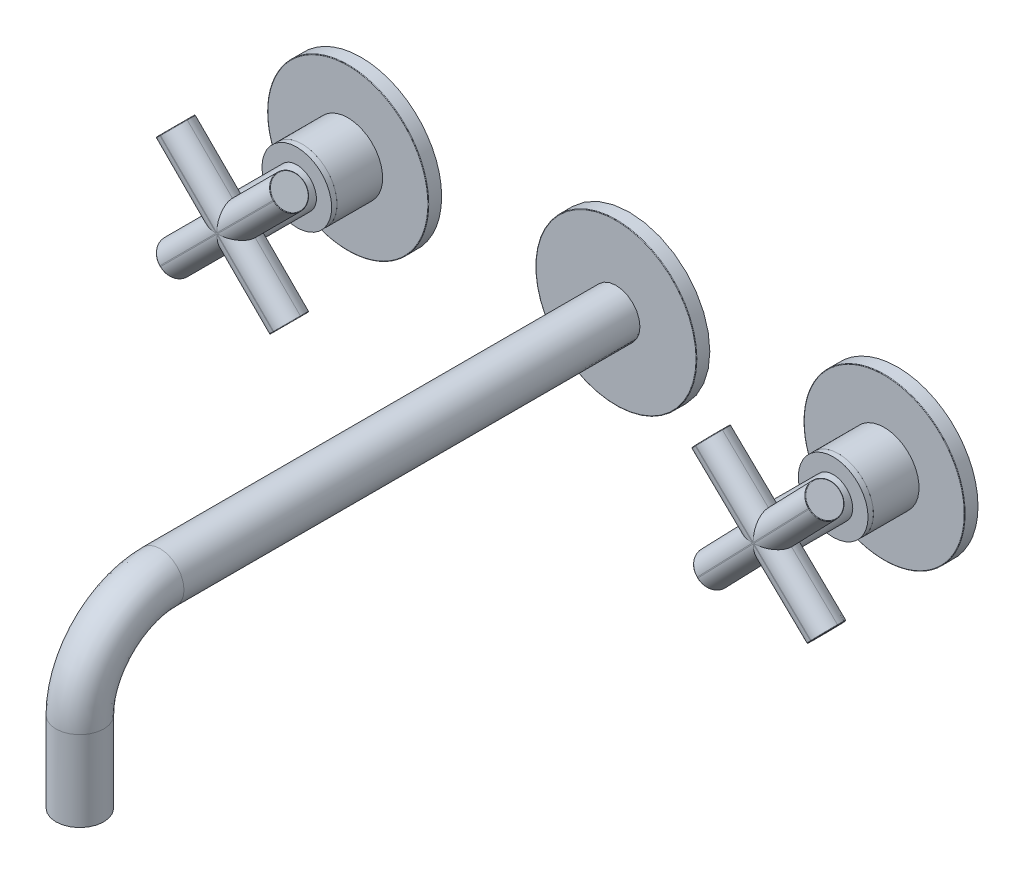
SolidWorks part; units mm, degrees
ref_plane "Front Plane" through (0, 0, 0) normal (0, 0, 1) x (1, 0, 0)
ref_plane "Top Plane" through (0, 0, 0) normal (0, 1, 0) x (1, 0, 0)
ref_plane "Right Plane" through (0, 0, 0) normal (1, 0, 0) x (0, 0, -1)
sketch "Sketch1" plane through (0, 0, 0) normal (0, 0, 1) x (1, 0, 0)
  line L0 (7.0266, -62.6003) -> (7.0266, -61.5741)
  line L1 (-7.0326, -61.5741) -> (-7.0326, -62.6003)
  line L2 (-9.2389, -0.0009) -> (-9.2389, -30.7875)
  line L3 (9.233, -30.7875) -> (9.233, 0.0018)
  line L4 (9.233, -61.5741) -> (9.233, -30.7875)
  line L5 (-9.2389, -30.7875) -> (-9.2389, -61.5741)
  line L6 (-102.625, 8.7069) -> (-120.0405, 26.1224)
  line L7 (-128.7483, 17.4147) -> (-111.3327, -0.0009)
  line L8 (-85.2094, 26.1224) -> (-102.625, 8.7069)
  line L9 (-93.9172, -0.0009) -> (-76.5017, 17.4147)
  line L10 (-111.3327, -0.0009) -> (-128.7483, -17.4164)
  line L11 (-120.0405, -26.1242) -> (-102.625, -8.7086)
  line L12 (-102.625, -8.7086) -> (-85.2094, -26.1242)
  line L13 (-76.5017, -17.4164) -> (-93.9172, -0.0009)
  line L14 (102.4671, 8.7056) -> (84.7502, 25.8145)
  line L15 (76.1958, 16.9561) -> (93.9126, -0.1528)
  line L16 (119.576, 26.4224) -> (102.4671, 8.7056)
  line L17 (111.3255, 0.1511) -> (128.4344, 17.8679)
  line L18 (102.771, -8.7073) -> (120.4878, -25.8163)
  line L19 (129.0423, -16.9578) -> (111.3255, 0.1511)
  line L20 (93.9126, -0.1528) -> (76.8037, -17.8697)
  line L21 (85.6621, -26.4241) -> (102.771, -8.7073)
  line L22 (-73.5991, -10.2631) -> (-29.0288, -10.2631)
  line L23 (29.0229, -10.2631) -> (73.5932, -10.2631)
  line L24 (73.5932, 10.2613) -> (29.0229, 10.2613)
  line L25 (-29.0288, 10.2613) -> (-73.5991, 10.2613)
  line L26 (10.958, -28.7702) -> (9.233, -29.3694)
  line L27 (7.0266, -62.6003) -> (-7.0326, -62.6003)
  line L28 (-1.0292, -63.1198) -> (1.0233, -63.1198)
  line L29 (9.233, -61.5741) -> (-9.2389, -61.5741)
  line L30 (-128.3084, -16.9766) -> (-129.7895, -14.4888)
  line L31 (-129.7895, -14.4888) -> (-131.061, -11.7994)
  line L32 (-102.625, -0.0009) -> (-111.3327, -0.0009)
  line L33 (-102.625, 8.7069) -> (-102.625, -0.0009)
  line L34 (-128.7483, 17.4147) -> (-128.6909, 17.472)
  line L35 (-128.6909, 17.472) -> (-128.439, 17.7239)
  line L36 (-128.439, 17.7239) -> (-127.998, 18.1649)
  line L37 (-127.998, 18.1649) -> (-127.3885, 18.7744)
  line L38 (-127.3885, 18.7744) -> (-126.639, 19.5239)
  line L39 (-126.639, 19.5239) -> (-125.7846, 20.3783)
  line L40 (-125.7846, 20.3783) -> (-124.8651, 21.2978)
  line L41 (-124.8651, 21.2978) -> (-123.9236, 22.2393)
  line L42 (-123.9236, 22.2393) -> (-123.0042, 23.1587)
  line L43 (-123.0042, 23.1587) -> (-122.1497, 24.0132)
  line L44 (-122.1497, 24.0132) -> (-121.4002, 24.7627)
  line L45 (-121.4002, 24.7627) -> (-120.7907, 25.3722)
  line L46 (-120.7907, 25.3722) -> (-120.3497, 25.8132)
  line L47 (-120.3497, 25.8132) -> (-120.0978, 26.0651)
  line L48 (-120.0978, 26.0651) -> (-120.0405, 26.1224)
  line L49 (-102.625, -0.0009) -> (-93.9172, -0.0009)
  line L50 (-85.2094, 26.1224) -> (-85.1521, 26.0651)
  line L51 (-85.1521, 26.0651) -> (-84.9002, 25.8132)
  line L52 (-84.9002, 25.8132) -> (-84.4592, 25.3722)
  line L53 (-84.4592, 25.3722) -> (-83.8497, 24.7627)
  line L54 (-83.8497, 24.7627) -> (-83.1002, 24.0132)
  line L55 (-83.1002, 24.0132) -> (-82.2457, 23.1587)
  line L56 (-82.2457, 23.1587) -> (-81.3263, 22.2393)
  line L57 (-81.3263, 22.2393) -> (-80.3848, 21.2978)
  line L58 (-80.3848, 21.2978) -> (-79.4653, 20.3783)
  line L59 (-79.4653, 20.3783) -> (-78.6109, 19.5239)
  line L60 (-78.6109, 19.5239) -> (-77.8614, 18.7744)
  line L61 (-77.8614, 18.7744) -> (-77.2519, 18.1649)
  line L62 (-77.2519, 18.1649) -> (-76.8109, 17.7239)
  line L63 (-76.8109, 17.7239) -> (-76.559, 17.472)
  line L64 (-76.559, 17.472) -> (-76.5017, 17.4147)
  line L65 (-102.625, -0.0009) -> (-102.625, -8.7086)
  line L66 (-120.0405, -26.1242) -> (-120.0978, -26.0668)
  line L67 (-120.0978, -26.0668) -> (-120.3497, -25.8149)
  line L68 (-120.3497, -25.8149) -> (-120.7907, -25.374)
  line L69 (-120.7907, -25.374) -> (-121.4002, -24.7645)
  line L70 (-121.4002, -24.7645) -> (-122.1497, -24.015)
  line L71 (-122.1497, -24.015) -> (-123.0042, -23.1605)
  line L72 (-123.0042, -23.1605) -> (-123.9236, -22.241)
  line L73 (-123.9236, -22.241) -> (-124.8651, -21.2996)
  line L74 (-124.8651, -21.2996) -> (-125.7846, -20.3801)
  line L75 (-125.7846, -20.3801) -> (-126.639, -19.5256)
  line L76 (-126.639, -19.5256) -> (-127.3885, -18.7761)
  line L77 (-127.3885, -18.7761) -> (-127.998, -18.1666)
  line L78 (-127.998, -18.1666) -> (-128.439, -17.7256)
  line L79 (-128.439, -17.7256) -> (-128.6909, -17.4738)
  line L80 (-128.6909, -17.4738) -> (-128.7483, -17.4164)
  line L81 (-76.5017, -17.4164) -> (-76.559, -17.4738)
  line L82 (-76.559, -17.4738) -> (-76.8109, -17.7256)
  line L83 (-76.8109, -17.7256) -> (-77.2519, -18.1666)
  line L84 (-77.2519, -18.1666) -> (-77.8614, -18.7761)
  line L85 (-77.8614, -18.7761) -> (-78.6109, -19.5256)
  line L86 (-78.6109, -19.5256) -> (-79.4653, -20.3801)
  line L87 (-79.4653, -20.3801) -> (-80.3848, -21.2996)
  line L88 (-80.3848, -21.2996) -> (-81.3263, -22.241)
  line L89 (-81.3263, -22.241) -> (-82.2457, -23.1605)
  line L90 (-82.2457, -23.1605) -> (-83.1002, -24.015)
  line L91 (-83.1002, -24.015) -> (-83.8497, -24.7645)
  line L92 (-83.8497, -24.7645) -> (-84.4592, -25.374)
  line L93 (-84.4592, -25.374) -> (-84.9002, -25.8149)
  line L94 (-84.9002, -25.8149) -> (-85.1521, -26.0668)
  line L95 (-85.1521, -26.0668) -> (-85.2094, -26.1242)
  line L96 (102.619, -0.0009) -> (101.0991, -0.0274)
  line L97 (101.0991, -0.0274) -> (99.6258, -0.0531)
  line L98 (99.6258, -0.0531) -> (98.2445, -0.0772)
  line L99 (98.2445, -0.0772) -> (96.9975, -0.099)
  line L100 (96.9975, -0.099) -> (95.9232, -0.1178)
  line L101 (95.9232, -0.1178) -> (95.0546, -0.1329)
  line L102 (95.0546, -0.1329) -> (94.4182, -0.144)
  line L103 (94.4182, -0.144) -> (94.0337, -0.1507)
  line L104 (94.0337, -0.1507) -> (93.9126, -0.1528)
  line L105 (102.4671, 8.7056) -> (102.4692, 8.5845)
  line L106 (102.4692, 8.5845) -> (102.4759, 8.2)
  line L107 (102.4759, 8.2) -> (102.487, 7.5636)
  line L108 (102.487, 7.5636) -> (102.5022, 6.6949)
  line L109 (102.5022, 6.6949) -> (102.5209, 5.6206)
  line L110 (102.5209, 5.6206) -> (102.5427, 4.3737)
  line L111 (102.5427, 4.3737) -> (102.5668, 2.9923)
  line L112 (102.5668, 2.9923) -> (102.5925, 1.5191)
  line L113 (102.5925, 1.5191) -> (102.619, -0.0009)
  line L114 (76.1958, 16.9561) -> (76.2521, 17.0144)
  line L115 (76.2521, 17.0144) -> (76.4996, 17.2707)
  line L116 (76.4996, 17.2707) -> (76.9328, 17.7193)
  line L117 (76.9328, 17.7193) -> (77.5316, 18.3393)
  line L118 (77.5316, 18.3393) -> (78.2679, 19.1018)
  line L119 (78.2679, 19.1018) -> (79.1073, 19.971)
  line L120 (79.1073, 19.971) -> (80.0106, 20.9064)
  line L121 (80.0106, 20.9064) -> (80.9355, 21.8642)
  line L122 (80.9355, 21.8642) -> (81.8388, 22.7995)
  line L123 (81.8388, 22.7995) -> (82.6782, 23.6688)
  line L124 (82.6782, 23.6688) -> (83.4145, 24.4313)
  line L125 (83.4145, 24.4313) -> (84.0132, 25.0513)
  line L126 (84.0132, 25.0513) -> (84.4465, 25.4999)
  line L127 (84.4465, 25.4999) -> (84.6939, 25.7561)
  line L128 (84.6939, 25.7561) -> (84.7502, 25.8145)
  line L129 (102.619, -0.0009) -> (104.139, 0.0257)
  line L130 (104.139, 0.0257) -> (105.6122, 0.0514)
  line L131 (105.6122, 0.0514) -> (106.9936, 0.0755)
  line L132 (106.9936, 0.0755) -> (108.2405, 0.0972)
  line L133 (108.2405, 0.0972) -> (109.3149, 0.116)
  line L134 (109.3149, 0.116) -> (110.1835, 0.1312)
  line L135 (110.1835, 0.1312) -> (110.8199, 0.1423)
  line L136 (110.8199, 0.1423) -> (111.2044, 0.149)
  line L137 (111.2044, 0.149) -> (111.3255, 0.1511)
  line L138 (119.576, 26.4224) -> (119.6344, 26.366)
  line L139 (119.6344, 26.366) -> (119.8906, 26.1186)
  line L140 (119.8906, 26.1186) -> (120.3392, 25.6854)
  line L141 (120.3392, 25.6854) -> (120.9593, 25.0866)
  line L142 (120.9593, 25.0866) -> (121.7217, 24.3503)
  line L143 (121.7217, 24.3503) -> (122.591, 23.5109)
  line L144 (122.591, 23.5109) -> (123.5263, 22.6076)
  line L145 (123.5263, 22.6076) -> (124.4841, 21.6827)
  line L146 (124.4841, 21.6827) -> (125.4195, 20.7794)
  line L147 (125.4195, 20.7794) -> (126.2887, 19.94)
  line L148 (126.2887, 19.94) -> (127.0512, 19.2037)
  line L149 (127.0512, 19.2037) -> (127.6712, 18.6049)
  line L150 (127.6712, 18.6049) -> (128.1198, 18.1717)
  line L151 (128.1198, 18.1717) -> (128.3761, 17.9243)
  line L152 (128.3761, 17.9243) -> (128.4344, 17.8679)
  line L153 (102.619, -0.0009) -> (102.6456, -1.5208)
  line L154 (102.6456, -1.5208) -> (102.6713, -2.9941)
  line L155 (102.6713, -2.9941) -> (102.6954, -4.3754)
  line L156 (102.6954, -4.3754) -> (102.7172, -5.6224)
  line L157 (102.7172, -5.6224) -> (102.7359, -6.6967)
  line L158 (102.7359, -6.6967) -> (102.7511, -7.5654)
  line L159 (102.7511, -7.5654) -> (102.7622, -8.2017)
  line L160 (102.7622, -8.2017) -> (102.7689, -8.5862)
  line L161 (102.7689, -8.5862) -> (102.771, -8.7073)
  line L162 (129.0423, -16.9578) -> (128.986, -17.0162)
  line L163 (128.986, -17.0162) -> (128.7385, -17.2724)
  line L164 (128.7385, -17.2724) -> (128.3053, -17.721)
  line L165 (128.3053, -17.721) -> (127.7065, -18.3411)
  line L166 (127.7065, -18.3411) -> (126.9702, -19.1036)
  line L167 (126.9702, -19.1036) -> (126.1308, -19.9728)
  line L168 (126.1308, -19.9728) -> (125.2275, -20.9082)
  line L169 (125.2275, -20.9082) -> (124.3026, -21.8659)
  line L170 (124.3026, -21.8659) -> (123.3993, -22.8013)
  line L171 (123.3993, -22.8013) -> (122.5599, -23.6705)
  line L172 (122.5599, -23.6705) -> (121.8236, -24.433)
  line L173 (121.8236, -24.433) -> (121.2249, -25.0531)
  line L174 (121.2249, -25.0531) -> (120.7916, -25.5017)
  line L175 (120.7916, -25.5017) -> (120.5442, -25.7579)
  line L176 (120.5442, -25.7579) -> (120.4878, -25.8163)
  line L177 (85.6621, -26.4241) -> (85.6037, -26.3678)
  line L178 (85.6037, -26.3678) -> (85.3475, -26.1204)
  line L179 (85.3475, -26.1204) -> (84.8989, -25.6871)
  line L180 (84.8989, -25.6871) -> (84.2788, -25.0884)
  line L181 (84.2788, -25.0884) -> (83.5164, -24.352)
  line L182 (83.5164, -24.352) -> (82.6471, -23.5126)
  line L183 (82.6471, -23.5126) -> (81.7118, -22.6094)
  line L184 (81.7118, -22.6094) -> (80.754, -21.6845)
  line L185 (80.754, -21.6845) -> (79.8186, -20.7812)
  line L186 (79.8186, -20.7812) -> (78.9494, -19.9418)
  line L187 (78.9494, -19.9418) -> (78.1869, -19.2055)
  line L188 (78.1869, -19.2055) -> (77.5669, -18.6067)
  line L189 (77.5669, -18.6067) -> (77.1182, -18.1735)
  line L190 (77.1182, -18.1735) -> (76.862, -17.926)
  line L191 (76.862, -17.926) -> (76.8037, -17.8697)
  line L192 (-0.003, -0.0009) -> (-0.003, -67.0618) construction
  line L193 (-93.9172, -0.0009) -> (93.9126, -0.1528) construction
  arc A0 (10.958, -28.7702) -> (-9.2389, -29.3694) centre (-0.003, -0.0009) ccw
  arc A1 (9.233, 0.0018) -> (-9.2389, -0.0009) centre (-0.003, 0.0018) ccw
  arc A2 (76.6432, 16.524) -> (77.2358, -17.4222) centre (102.619, -0.0009) ccw
  arc A3 (119.1439, 25.9749) -> (85.1977, 25.3824) centre (102.619, -0.0009) ccw
  arc A4 (128.5949, -16.5258) -> (128.0023, 17.4205) centre (102.619, -0.0009) ccw
  arc A5 (86.0942, -25.9767) -> (120.0404, -25.3842) centre (102.619, -0.0009) ccw
  arc A6 (89.8285, 3.7912) -> (89.9975, -4.3223) centre (102.619, -0.0009) ccw
  arc A7 (106.4111, 12.7897) -> (98.3829, 12.6496) centre (102.619, -0.0009) ccw
  arc A8 (115.4096, -3.7929) -> (115.2695, 4.2352) centre (102.619, -0.0009) ccw
  arc A9 (98.827, -12.7915) -> (106.8552, -12.6513) centre (102.619, -0.0009) ccw
  arc A10 (-115.3474, 4.0138) -> (-115.3474, -4.0156) centre (-102.625, -0.0009) ccw
  arc A11 (-98.6103, 12.7216) -> (-106.6396, 12.7216) centre (-102.625, -0.0009) ccw
  arc A12 (-89.9025, -4.0156) -> (-89.9025, 4.0138) centre (-102.625, -0.0009) ccw
  arc A13 (-106.6396, -12.7233) -> (-98.6103, -12.7233) centre (-102.625, -0.0009) ccw
  arc A14 (-128.3084, 16.9748) -> (-131.061, -11.7994) centre (-102.625, -0.0009) ccw
  arc A15 (-85.6493, 25.6826) -> (-119.6007, 25.6826) centre (-102.625, -0.0009) ccw
  arc A16 (-76.9415, -16.9766) -> (-76.9415, 16.9748) centre (-102.625, -0.0009) ccw
  arc A17 (-119.6007, -25.6843) -> (-85.6493, -25.6843) centre (-102.625, -0.0009) ccw
  arc A18 (-106.2284, -12.3121) -> (-99.0215, -12.3121) centre (-102.625, -0.0009) ccw
  arc A19 (-90.3103, -3.5926) -> (-90.3103, 3.5909) centre (-102.625, -0.0009) ccw
  arc A20 (-99.0215, 12.3103) -> (-106.2284, 12.3103) centre (-102.625, -0.0009) ccw
  arc A21 (-114.9362, 3.6026) -> (-114.9362, -3.6043) centre (-102.625, -0.0009) ccw
  arc A22 (99.231, -12.3731) -> (106.4368, -12.2473) centre (102.619, -0.0009) ccw
  arc A23 (114.9913, -3.3889) -> (114.8655, 3.8169) centre (102.619, -0.0009) ccw
  arc A24 (106.0071, 12.3714) -> (98.8013, 12.2456) centre (102.619, -0.0009) ccw
  arc A25 (90.2468, 3.3872) -> (90.3726, -3.8186) centre (102.619, -0.0009) ccw
  spline S0 degree 3 poles (1.0219, -63.5529) (1.299, -63.5355) (2.2375, -63.4765) (3.8483, -63.2268) (5.1287, -62.8111) (5.7779, -62.6003) knots 0 0 0 0 0.171148 0.579779 1 1 1 1
  spline S1 degree 3 poles (-5.8948, -62.6003) (-5.5796, -62.7093) (-4.6297, -63.038) (-2.9979, -63.3764) (-1.6765, -63.4771) (-1.0248, -63.5268) knots 0 0 0 0 0.201052 0.60601 1 1 1 1
  spline S2 degree 3 poles (1.0233, -63.1198) (1.0233, -63.1458) (1.0233, -63.4181) (1.0233, -63.4987) (1.0233, -63.5716) knots 0 0 0 0 0.095561 1 1 1 1
  spline S3 degree 3 poles (-1.0292, -63.1198) (-1.0292, -63.1458) (-1.0292, -63.4179) (-1.0292, -63.4984) (-1.0292, -63.5713) knots 0 0 0 0 0.095626 1 1 1 1
sketch "Sketch2" plane through (0, 0, 0) normal (1, 0, 0) x (0, 0, -1)
  line L0 (-203.3287, -62.5994) -> (-203.3287, -61.5732)
  line L1 (-217.3879, -61.5732) -> (-217.3879, -62.5994)
  line L2 (-206.3885, -63.1337) -> (-204.5775, -62.5994)
  line L3 (-179.5717, -9.236) -> (-55.3991, -9.236)
  line L4 (-43.0844, -9.236) -> (-24.6125, -9.236)
  line L5 (-24.6125, 9.236) -> (-43.0844, 9.236)
  line L6 (-55.3991, 9.236) -> (-179.5717, 9.236)
  line L7 (-201.1223, -61.5732) -> (-201.1223, -30.7866)
  line L8 (-219.5943, -30.7866) -> (-219.5943, -61.5732)
  line L9 (-0.0202, 30.7866) -> (-5.1143, 30.7866)
  line L10 (-5.1143, -30.7866) -> (-0.0013, -30.7866)
  line L11 (-55.3991, 0) -> (-55.3991, -21.3862)
  line L12 (-43.0844, -21.3862) -> (-43.0844, -5.1706)
  line L13 (-55.3991, 22.146) -> (-55.3991, 0)
  line L14 (-43.0844, 5.3544) -> (-43.0844, 22.146)
  line L15 (-43.0844, -7.4914) -> (-24.6125, -7.4914)
  line L16 (-24.6125, 7.4914) -> (-43.0844, 7.4914)
  line L17 (-55.3991, -21.3862) -> (-55.3991, -22.146)
  line L18 (-43.0844, -22.146) -> (-43.0844, -21.3862)
  line L19 (-24.6125, -12.8278) -> (-22.56, -12.8278)
  line L20 (-22.56, 12.8278) -> (-24.6125, 12.8278)
  line L21 (-5.1143, 12.8278) -> (-22.56, 12.8278)
  line L22 (-22.56, -12.8278) -> (-5.1143, -12.8278)
  line L23 (-203.3287, -62.5994) -> (-217.3879, -62.5994)
  line L24 (-210.3583, -61.5732) -> (-219.5943, -61.5732)
  line L25 (-201.1223, -61.5732) -> (-210.3583, -61.5732)
  line L26 (-5.1143, 30.7866) -> (-5.1143, -30.7866)
  line L27 (-0.0202, 30.7866) -> (-0.0013, -30.7866)
  line L28 (-43.0844, -21.3862) -> (-43.2284, -20.434)
  line L29 (-43.2284, -20.434) -> (-43.6535, -19.5264)
  line L30 (-43.6535, -19.5264) -> (-44.3399, -18.7057)
  line L31 (-44.3399, -18.7057) -> (-45.2556, -18.0104)
  line L32 (-45.2556, -18.0104) -> (-46.3576, -17.4729)
  line L33 (-46.3576, -17.4729) -> (-47.5945, -17.1184)
  line L34 (-47.5945, -17.1184) -> (-48.9084, -16.9635)
  line L35 (-48.9084, -16.9635) -> (-50.2379, -17.0153)
  line L36 (-50.2379, -17.0153) -> (-51.5208, -17.2715)
  line L37 (-51.5208, -17.2715) -> (-52.6971, -17.7202)
  line L38 (-52.6971, -17.7202) -> (-53.7119, -18.3402)
  line L39 (-53.7119, -18.3402) -> (-54.5177, -19.1027)
  line L40 (-54.5177, -19.1027) -> (-55.0767, -19.9719)
  line L41 (-55.0767, -19.9719) -> (-55.363, -20.9073)
  line L42 (-55.363, -20.9073) -> (-55.363, -21.8651)
  line L43 (-55.363, -21.8651) -> (-55.0767, -22.8004)
  line L44 (-55.0767, -22.8004) -> (-54.5177, -23.6697)
  line L45 (-54.5177, -23.6697) -> (-53.7119, -24.4321)
  line L46 (-53.7119, -24.4321) -> (-52.6971, -25.0522)
  line L47 (-52.6971, -25.0522) -> (-51.5208, -25.5008)
  line L48 (-51.5208, -25.5008) -> (-50.2379, -25.757)
  line L49 (-50.2379, -25.757) -> (-48.9084, -25.8089)
  line L50 (-48.9084, -25.8089) -> (-47.5945, -25.6539)
  line L51 (-47.5945, -25.6539) -> (-46.3576, -25.2994)
  line L52 (-46.3576, -25.2994) -> (-45.2556, -24.7619)
  line L53 (-45.2556, -24.7619) -> (-44.3399, -24.0666)
  line L54 (-44.3399, -24.0666) -> (-43.6535, -23.2459)
  line L55 (-43.6535, -23.2459) -> (-43.2284, -22.3383)
  line L56 (-43.2284, -22.3383) -> (-43.0844, -21.3862)
  line L57 (-43.0844, 22.146) -> (-43.2284, 23.0655)
  line L58 (-43.2284, 23.0655) -> (-43.6535, 23.942)
  line L59 (-43.6535, 23.942) -> (-44.3399, 24.7345)
  line L60 (-44.3399, 24.7345) -> (-45.2556, 25.406)
  line L61 (-45.2556, 25.406) -> (-46.3576, 25.925)
  line L62 (-46.3576, 25.925) -> (-47.5945, 26.2674)
  line L63 (-47.5945, 26.2674) -> (-48.9084, 26.417)
  line L64 (-48.9084, 26.417) -> (-50.2379, 26.3669)
  line L65 (-50.2379, 26.3669) -> (-51.5208, 26.1195)
  line L66 (-51.5208, 26.1195) -> (-52.6971, 25.6862)
  line L67 (-52.6971, 25.6862) -> (-53.7119, 25.0875)
  line L68 (-53.7119, 25.0875) -> (-54.5177, 24.3512)
  line L69 (-54.5177, 24.3512) -> (-55.0767, 23.5118)
  line L70 (-55.0767, 23.5118) -> (-55.363, 22.6085)
  line L71 (-55.363, 22.6085) -> (-55.363, 21.6836)
  line L72 (-55.363, 21.6836) -> (-55.0767, 20.7803)
  line L73 (-55.0767, 20.7803) -> (-54.5177, 19.9409)
  line L74 (-54.5177, 19.9409) -> (-53.7119, 19.2046)
  line L75 (-53.7119, 19.2046) -> (-52.6971, 18.6058)
  line L76 (-52.6971, 18.6058) -> (-51.5208, 18.1726)
  line L77 (-51.5208, 18.1726) -> (-50.2379, 17.9251)
  line L78 (-50.2379, 17.9251) -> (-48.9084, 17.8751)
  line L79 (-48.9084, 17.8751) -> (-47.5945, 18.0247)
  line L80 (-47.5945, 18.0247) -> (-46.3576, 18.367)
  line L81 (-46.3576, 18.367) -> (-45.2556, 18.8861)
  line L82 (-45.2556, 18.8861) -> (-44.3399, 19.5576)
  line L83 (-44.3399, 19.5576) -> (-43.6535, 20.3501)
  line L84 (-43.6535, 20.3501) -> (-43.2284, 21.2265)
  line L85 (-43.2284, 21.2265) -> (-43.0844, 22.146)
  line L86 (-43.0844, -22.146) -> (-43.2284, -23.0655)
  line L87 (-43.2284, -23.0655) -> (-43.6535, -23.942)
  line L88 (-43.6535, -23.942) -> (-44.3399, -24.7345)
  line L89 (-44.3399, -24.7345) -> (-45.2556, -25.406)
  line L90 (-45.2556, -25.406) -> (-46.3576, -25.925)
  line L91 (-46.3576, -25.925) -> (-47.5945, -26.2674)
  line L92 (-47.5945, -26.2674) -> (-48.9084, -26.417)
  line L93 (-48.9084, -26.417) -> (-50.2379, -26.3669)
  line L94 (-50.2379, -26.3669) -> (-51.5208, -26.1195)
  line L95 (-51.5208, -26.1195) -> (-52.6971, -25.6862)
  line L96 (-52.6971, -25.6862) -> (-53.7119, -25.0875)
  line L97 (-53.7119, -25.0875) -> (-54.5177, -24.3512)
  line L98 (-54.5177, -24.3512) -> (-55.0767, -23.5118)
  line L99 (-55.0767, -23.5118) -> (-55.363, -22.6085)
  line L100 (-55.363, -22.6085) -> (-55.3991, -22.146)
  line L101 (-27.716, -3.7034) -> (-25.6194, -3.7034)
  line L102 (-24.6125, -12.8278) -> (-24.6125, 12.8278)
  line L103 (-22.56, -12.8278) -> (-22.56, 12.8278)
  line L104 (-22.56, 0.5275) -> (-22.56, 12.8278)
  line L105 (-22.56, -12.8278) -> (-22.56, 0.5275)
  line L106 (-179.5717, -0.2309) -> (-55.3991, -0.2309) construction
  line L107 (-210.1274, -65.6392) -> (-210.1274, -30.7866) construction
  arc A0 (-179.5717, -9.236) -> (-201.1223, -30.7866) centre (-179.5717, -30.7866) ccw
  arc A1 (-179.5717, 9.236) -> (-219.5943, -30.7866) centre (-179.5717, -30.7866) ccw
  arc A2 (-179.5717, -0.2309) -> (-210.1274, -30.7866) centre (-179.5717, -30.7866) ccw construction
  ellipse E0 centre (-49.2417, 0) end of major axis (-43.0844, 0) minor radius 0.152 (-46.1029, 0.1307) -> (-55.3991, 0) ccw
  spline S0 degree 3 poles (-216.2501, -62.5994) (-215.9359, -62.7126) (-215.308, -62.9387) (-214.6521, -63.0612) (-214.3245, -63.1224) knots 0 0 0 0 0.500496 1 1 1 1
  spline S1 degree 3 poles (-214.3237, -63.119) (-214.1993, -63.1447) (-212.8929, -63.4148) (-210.2202, -63.756) (-207.7081, -63.3379) (-206.3928, -63.119) knots 0 0 0 0 0.047765 0.501401 1 1 1 1
  spline S2 degree 3 poles (-43.1429, -5.1715) (-43.1354, -4.9378) (-43.1156, -4.3228) (-43.5828, -3.0715) (-44.4661, -1.5483) (-45.4007, -0.4733) (-46.0195, 0.0589) (-46.1029, 0.1307) knots 0 0 0 0 0.144967 0.381516 0.639527 0.951378 1 1 1 1
  spline S3 degree 3 poles (-46.1029, 0.1307) (-45.5491, 0.6699) (-44.4994, 1.6919) (-43.5423, 3.3858) (-43.0826, 4.6535) (-43.129, 5.1925) (-43.1429, 5.3535) knots 0 0 0 0 0.338339 0.641343 0.892827 1 1 1 1
  spline S4 degree 3 poles (-28.82, -5.204) (-28.7971, -5.0289) (-28.7514, -4.6788) (-28.3965, -4.1572) (-27.8667, -3.7248) (-27.1898, -3.4544) (-26.46, -3.406) (-25.7648, -3.5771) (-25.1748, -3.9319) (-24.7574, -4.3628) (-24.6535, -4.6648) (-24.6125, -4.7842) knots 0 0 0 0 0.114018 0.22793 0.344584 0.463574 0.579443 0.691533 0.805094 0.922986 1 1 1 1
  spline S5 degree 3 poles (-24.6125, -5.601) (-24.6607, -5.7077) (-24.7773, -5.9654) (-25.2065, -6.2573) (-25.8196, -6.4706) (-26.5398, -6.5528) (-27.2585, -6.5124) (-27.9062, -6.3541) (-28.4248, -6.071) (-28.7602, -5.6793) (-28.801, -5.355) (-28.82, -5.204) knots 0 0 0 0 0.08141 0.196554 0.315497 0.433759 0.547501 0.660093 0.776509 0.895909 1 1 1 1
sketch "Sketch3" plane through (0, 0, 0) normal (0, 1, 0) x (1, 0, 0)
  line L0 (30.7866, -4.1049) -> (30.7866, 0)
  line L1 (-30.7866, 0) -> (-30.7866, -4.1049)
  line L2 (9.236, -179.5885) -> (9.236, -5.1311)
  line L3 (-9.236, -5.1311) -> (-9.236, -179.5885)
  line L4 (-9.236, -179.5885) -> (-9.236, -210.3751)
  line L5 (9.236, -210.3751) -> (9.236, -179.5885)
  line L6 (71.8354, 0) -> (71.8354, -5.1311)
  line L7 (133.4086, -5.1311) -> (133.4086, 0)
  line L8 (-133.4086, 0) -> (-133.4086, -5.1311)
  line L9 (-71.8354, -5.1311) -> (-71.8354, 0)
  line L10 (-80.8526, -43.1012) -> (-97.3587, -43.1012)
  line L11 (-102.622, -55.4159) -> (-80.8526, -55.4159)
  line L12 (-107.8853, -43.1012) -> (-124.3914, -43.1012)
  line L13 (-124.3914, -55.4159) -> (-102.622, -55.4159)
  line L14 (-95.1306, -43.1012) -> (-95.1306, -24.6293)
  line L15 (-110.1134, -24.6293) -> (-110.1134, -43.1012)
  line L16 (124.0082, -43.1012) -> (107.7926, -43.1012)
  line L17 (102.622, -55.4159) -> (124.0082, -55.4159)
  line L18 (97.2676, -43.1012) -> (80.476, -43.1012)
  line L19 (80.476, -55.4159) -> (102.622, -55.4159)
  line L20 (110.1134, -43.1012) -> (110.1134, -24.6293)
  line L21 (95.1306, -24.6293) -> (95.1306, -43.1012)
  line L22 (124.0082, -55.4159) -> (124.768, -55.4159)
  line L23 (124.768, -43.1012) -> (124.0082, -43.1012)
  line L24 (-89.7943, -24.6293) -> (-89.7943, -22.5768)
  line L25 (-115.4498, -22.5768) -> (-115.4498, -24.6293)
  line L26 (115.4498, -24.6293) -> (115.4498, -22.5768)
  line L27 (89.7942, -22.5768) -> (89.7942, -24.6293)
  line L28 (-115.4498, -5.1311) -> (-115.4498, -22.5768)
  line L29 (-89.7943, -22.5768) -> (-89.7943, -5.1311)
  line L30 (89.7942, -5.1311) -> (89.7942, -22.5768)
  line L31 (115.4498, -22.5768) -> (115.4498, -5.1311)
  line L32 (-30.7866, 0) -> (30.7866, 0)
  line L33 (29.7604, -5.1311) -> (-29.7604, -5.1311)
  line L34 (71.8354, 0) -> (133.4086, 0)
  line L35 (71.8354, -5.1311) -> (133.4086, -5.1311)
  line L36 (-133.4086, -5.1311) -> (-71.8354, -5.1311)
  line L37 (-133.4086, 0) -> (-71.8354, 0)
  line L38 (-80.8526, -43.1012) -> (-81.7885, -43.2452)
  line L39 (-81.7885, -43.2452) -> (-82.6807, -43.6703)
  line L40 (-82.6807, -43.6703) -> (-83.4874, -44.3568)
  line L41 (-83.4874, -44.3568) -> (-84.171, -45.2724)
  line L42 (-84.171, -45.2724) -> (-84.6993, -46.3744)
  line L43 (-84.6993, -46.3744) -> (-85.0478, -47.6113)
  line L44 (-85.0478, -47.6113) -> (-85.2001, -48.9252)
  line L45 (-85.2001, -48.9252) -> (-85.1491, -50.2547)
  line L46 (-85.1491, -50.2547) -> (-84.8972, -51.5376)
  line L47 (-84.8972, -51.5376) -> (-84.4563, -52.714)
  line L48 (-84.4563, -52.714) -> (-83.8468, -53.7287)
  line L49 (-83.8468, -53.7287) -> (-83.0973, -54.5345)
  line L50 (-83.0973, -54.5345) -> (-82.2428, -55.0936)
  line L51 (-82.2428, -55.0936) -> (-81.3233, -55.3798)
  line L52 (-81.3233, -55.3798) -> (-80.3819, -55.3798)
  line L53 (-80.3819, -55.3798) -> (-79.4624, -55.0936)
  line L54 (-79.4624, -55.0936) -> (-78.6079, -54.5345)
  line L55 (-78.6079, -54.5345) -> (-77.8584, -53.7287)
  line L56 (-77.8584, -53.7287) -> (-77.2489, -52.714)
  line L57 (-77.2489, -52.714) -> (-76.8079, -51.5376)
  line L58 (-76.8079, -51.5376) -> (-76.5561, -50.2547)
  line L59 (-76.5561, -50.2547) -> (-76.5051, -48.9252)
  line L60 (-76.5051, -48.9252) -> (-76.6574, -47.6113)
  line L61 (-76.6574, -47.6113) -> (-77.0059, -46.3744)
  line L62 (-77.0059, -46.3744) -> (-77.5342, -45.2724)
  line L63 (-77.5342, -45.2724) -> (-78.2177, -44.3568)
  line L64 (-78.2177, -44.3568) -> (-79.0244, -43.6703)
  line L65 (-79.0244, -43.6703) -> (-79.9166, -43.2452)
  line L66 (-79.9166, -43.2452) -> (-80.8526, -43.1012)
  line L67 (-102.622, -46.1198) -> (-102.622, -55.4159)
  line L68 (-124.3914, -43.1012) -> (-125.3274, -43.2452)
  line L69 (-125.3274, -43.2452) -> (-126.2196, -43.6703)
  line L70 (-126.2196, -43.6703) -> (-127.0263, -44.3568)
  line L71 (-127.0263, -44.3568) -> (-127.7098, -45.2724)
  line L72 (-127.7098, -45.2724) -> (-128.2381, -46.3744)
  line L73 (-128.2381, -46.3744) -> (-128.5866, -47.6113)
  line L74 (-128.5866, -47.6113) -> (-128.7389, -48.9252)
  line L75 (-128.7389, -48.9252) -> (-128.6879, -50.2547)
  line L76 (-128.6879, -50.2547) -> (-128.4361, -51.5376)
  line L77 (-128.4361, -51.5376) -> (-127.9951, -52.714)
  line L78 (-127.9951, -52.714) -> (-127.3856, -53.7287)
  line L79 (-127.3856, -53.7287) -> (-126.6361, -54.5345)
  line L80 (-126.6361, -54.5345) -> (-125.7816, -55.0936)
  line L81 (-125.7816, -55.0936) -> (-124.8622, -55.3798)
  line L82 (-124.8622, -55.3798) -> (-123.9207, -55.3798)
  line L83 (-123.9207, -55.3798) -> (-123.0012, -55.0936)
  line L84 (-123.0012, -55.0936) -> (-122.1468, -54.5345)
  line L85 (-122.1468, -54.5345) -> (-121.3973, -53.7287)
  line L86 (-121.3973, -53.7287) -> (-120.7878, -52.714)
  line L87 (-120.7878, -52.714) -> (-120.3468, -51.5376)
  line L88 (-120.3468, -51.5376) -> (-120.0949, -50.2547)
  line L89 (-120.0949, -50.2547) -> (-120.0439, -48.9252)
  line L90 (-120.0439, -48.9252) -> (-120.1962, -47.6113)
  line L91 (-120.1962, -47.6113) -> (-120.5447, -46.3744)
  line L92 (-120.5447, -46.3744) -> (-121.0731, -45.2724)
  line L93 (-121.0731, -45.2724) -> (-121.7566, -44.3568)
  line L94 (-121.7566, -44.3568) -> (-122.5633, -43.6703)
  line L95 (-122.5633, -43.6703) -> (-123.4555, -43.2452)
  line L96 (-123.4555, -43.2452) -> (-124.3914, -43.1012)
  line L97 (124.0082, -43.1012) -> (123.056, -43.2452)
  line L98 (123.056, -43.2452) -> (122.1484, -43.6703)
  line L99 (122.1484, -43.6703) -> (121.3277, -44.3568)
  line L100 (121.3277, -44.3568) -> (120.6324, -45.2724)
  line L101 (120.6324, -45.2724) -> (120.0949, -46.3744)
  line L102 (120.0949, -46.3744) -> (119.7404, -47.6113)
  line L103 (119.7404, -47.6113) -> (119.5855, -48.9252)
  line L104 (119.5855, -48.9252) -> (119.6373, -50.2547)
  line L105 (119.6373, -50.2547) -> (119.8935, -51.5376)
  line L106 (119.8935, -51.5376) -> (120.3422, -52.714)
  line L107 (120.3422, -52.714) -> (120.9622, -53.7287)
  line L108 (120.9622, -53.7287) -> (121.7247, -54.5345)
  line L109 (121.7247, -54.5345) -> (122.5939, -55.0936)
  line L110 (122.5939, -55.0936) -> (123.5293, -55.3798)
  line L111 (123.5293, -55.3798) -> (124.487, -55.3798)
  line L112 (124.487, -55.3798) -> (125.4224, -55.0936)
  line L113 (125.4224, -55.0936) -> (126.2917, -54.5345)
  line L114 (126.2917, -54.5345) -> (127.0541, -53.7287)
  line L115 (127.0541, -53.7287) -> (127.6742, -52.714)
  line L116 (127.6742, -52.714) -> (128.1228, -51.5376)
  line L117 (128.1228, -51.5376) -> (128.379, -50.2547)
  line L118 (128.379, -50.2547) -> (128.4309, -48.9252)
  line L119 (128.4309, -48.9252) -> (128.2759, -47.6113)
  line L120 (128.2759, -47.6113) -> (127.9214, -46.3744)
  line L121 (127.9214, -46.3744) -> (127.3839, -45.2724)
  line L122 (127.3839, -45.2724) -> (126.6886, -44.3568)
  line L123 (126.6886, -44.3568) -> (125.8679, -43.6703)
  line L124 (125.8679, -43.6703) -> (124.9603, -43.2452)
  line L125 (124.9603, -43.2452) -> (124.0082, -43.1012)
  line L126 (80.476, -43.1012) -> (79.5565, -43.2452)
  line L127 (79.5565, -43.2452) -> (78.68, -43.6703)
  line L128 (78.68, -43.6703) -> (77.8875, -44.3568)
  line L129 (77.8875, -44.3568) -> (77.216, -45.2724)
  line L130 (77.216, -45.2724) -> (76.697, -46.3744)
  line L131 (76.697, -46.3744) -> (76.3546, -47.6113)
  line L132 (76.3546, -47.6113) -> (76.205, -48.9252)
  line L133 (76.205, -48.9252) -> (76.2551, -50.2547)
  line L134 (76.2551, -50.2547) -> (76.5025, -51.5376)
  line L135 (76.5025, -51.5376) -> (76.9358, -52.714)
  line L136 (76.9358, -52.714) -> (77.5345, -53.7287)
  line L137 (77.5345, -53.7287) -> (78.2708, -54.5345)
  line L138 (78.2708, -54.5345) -> (79.1102, -55.0936)
  line L139 (79.1102, -55.0936) -> (80.0135, -55.3798)
  line L140 (80.0135, -55.3798) -> (80.9384, -55.3798)
  line L141 (80.9384, -55.3798) -> (81.8417, -55.0936)
  line L142 (81.8417, -55.0936) -> (82.6811, -54.5345)
  line L143 (82.6811, -54.5345) -> (83.4174, -53.7287)
  line L144 (83.4174, -53.7287) -> (84.0162, -52.714)
  line L145 (84.0162, -52.714) -> (84.4494, -51.5376)
  line L146 (84.4494, -51.5376) -> (84.6969, -50.2547)
  line L147 (84.6969, -50.2547) -> (84.7469, -48.9252)
  line L148 (84.7469, -48.9252) -> (84.5973, -47.6113)
  line L149 (84.5973, -47.6113) -> (84.255, -46.3744)
  line L150 (84.255, -46.3744) -> (83.7359, -45.2724)
  line L151 (83.7359, -45.2724) -> (83.0644, -44.3568)
  line L152 (83.0644, -44.3568) -> (82.2719, -43.6703)
  line L153 (82.2719, -43.6703) -> (81.3955, -43.2452)
  line L154 (81.3955, -43.2452) -> (80.476, -43.1012)
  line L155 (124.768, -43.1012) -> (125.6875, -43.2452)
  line L156 (125.6875, -43.2452) -> (126.564, -43.6703)
  line L157 (126.564, -43.6703) -> (127.3565, -44.3568)
  line L158 (127.3565, -44.3568) -> (128.028, -45.2724)
  line L159 (128.028, -45.2724) -> (128.547, -46.3744)
  line L160 (128.547, -46.3744) -> (128.8894, -47.6113)
  line L161 (128.8894, -47.6113) -> (129.039, -48.9252)
  line L162 (129.039, -48.9252) -> (128.9889, -50.2547)
  line L163 (128.9889, -50.2547) -> (128.7415, -51.5376)
  line L164 (128.7415, -51.5376) -> (128.3083, -52.714)
  line L165 (128.3083, -52.714) -> (127.7095, -53.7287)
  line L166 (127.7095, -53.7287) -> (126.9732, -54.5345)
  line L167 (126.9732, -54.5345) -> (126.1338, -55.0936)
  line L168 (126.1338, -55.0936) -> (125.2305, -55.3798)
  line L169 (125.2305, -55.3798) -> (124.768, -55.4159)
  line L170 (-89.7943, -24.6293) -> (-115.4498, -24.6293)
  line L171 (-89.7943, -22.5768) -> (-115.4498, -22.5768)
  line L172 (115.4498, -24.6293) -> (89.7942, -24.6293)
  line L173 (115.4498, -22.5768) -> (89.7942, -22.5768)
  line L174 (-133.4086, 0) -> (-133.4086, -5.1311)
  line L175 (89.7942, -22.5768) -> (115.4498, -22.5768)
  line L176 (115.4498, -24.6293) -> (89.7942, -24.6293)
  line L177 (89.7942, -22.5768) -> (89.7942, -5.1311)
  line L178 (94.8691, -43.1012) -> (94.8691, -24.6293)
  line L179 (-115.4498, -22.5768) -> (-89.7943, -22.5768)
  line L180 (-115.4498, -22.5768) -> (-115.4498, -5.1311)
  line L181 (133.4086, 0) -> (133.4086, -5.1311)
  arc A0 (-30.7866, -4.1049) -> (-29.7604, -5.1311) centre (-29.7604, -4.1049) ccw
  arc A1 (29.7604, -5.1311) -> (30.7866, -4.1049) centre (29.7604, -4.1049) ccw
  arc A2 (-9.236, -210.3751) -> (9.236, -210.3751) centre (0, -210.3751) ccw
  ellipse E0 centre (102.622, -49.2586) end of major axis (102.622, -43.1012) minor radius 0.152 (102.4913, -46.1198) -> (102.622, -55.4159) ccw
  spline S0 degree 3 poles (-97.3578, -43.1597) (-97.5874, -43.1522) (-98.1916, -43.1325) (-99.4309, -43.5997) (-100.9449, -44.4829) (-102.018, -45.4175) (-102.5502, -46.0363) (-102.622, -46.1198) knots 0 0 0 0 0.144967 0.381516 0.639527 0.951378 1 1 1 1
  spline S1 degree 3 poles (-102.622, -46.1198) (-103.1617, -45.566) (-104.1848, -44.5162) (-105.8896, -43.5591) (-107.1707, -43.0995) (-107.7202, -43.1458) (-107.8844, -43.1597) knots 0 0 0 0 0.338339 0.641342 0.892827 1 1 1 1
  spline S2 degree 3 poles (107.7935, -43.1597) (107.5598, -43.1522) (106.9448, -43.1325) (105.6935, -43.5997) (104.1703, -44.4829) (103.0953, -45.4175) (102.563, -46.0363) (102.4913, -46.1198) knots 0 0 0 0 0.144967 0.381516 0.639527 0.951378 1 1 1 1
  spline S3 degree 3 poles (102.4913, -46.1198) (101.9521, -45.566) (100.9301, -44.5162) (99.2363, -43.5591) (97.9685, -43.0995) (97.4295, -43.1458) (97.2685, -43.1597) knots 0 0 0 0 0.338338 0.641341 0.892828 1 1 1 1
sketch "Sketch4" plane through (0, 0, 0) normal (0, 0, 1) x (1, 0, 0)
  circle A0 centre (-102.625, -0.0009) radius 30.7866
  arc A1 (-85.6493, 25.6826) -> (-119.6007, 25.6826) centre (-102.625, -0.0009) ccw construction
  circle A2 centre (-0.003, -0.0009) radius 30.7866
  circle A3 centre (102.619, -0.0009) radius 30.7866
  arc A4 (10.958, -28.7702) -> (-9.2389, -29.3694) centre (-0.003, -0.0009) ccw construction
  arc A5 (119.1439, 25.9749) -> (85.1977, 25.3824) centre (102.619, -0.0009) ccw construction
extrude "Extrude1" add sketch "Sketch4" along normal up to vertex
sketch "Sketch5" plane through (0, 0, 5.1143) normal (0, 0, 1) x (1, 0, 0)
  circle A0 centre (-102.625, -0.0009) radius 13.3409
  circle A2 centre (102.619, -0.0009) radius 13.3409
  arc A3 (115.4096, -3.7929) -> (115.2695, 4.2352) centre (102.619, -0.0009) ccw construction
  arc A4 (-98.6103, 12.7216) -> (-106.6396, 12.7216) centre (-102.625, -0.0009) ccw construction
extrude "Extrude2" add sketch "Sketch5" along normal up to vertex
sketch "Sketch6" plane through (0, 0, 22.5768) normal (0, 0, 1) x (1, 0, 0)
  circle A1 centre (-102.625, -0.0009) radius 13.3409
  circle A2 centre (-102.625, -0.0009) radius 13.3409
  circle A3 centre (102.619, -0.0009) radius 13.3409
  circle A4 centre (102.619, -0.0009) radius 13.3409
  dimension "D1" = 0
  dimension "D2" = 0
extrude "Extrude3" add sketch "Sketch6" along normal up to vertex separate body
sketch "Sketch10" plane through (0, 0, 24.6293) normal (0, 0, 1) x (1, 0, 0)
  circle A0 centre (-102.625, -0.0009) radius 7.4944
  circle A1 centre (102.619, -0.0009) radius 7.4944
extrude "Extrude4" add sketch "Sketch10" along normal up to vertex
sketch "Sketch11" plane through (0, 0, 49.2586) normal (0, 0, 1) x (1, 0, 0)
  line L0 (-85.2094, 26.1224) -> (-102.625, 8.7069) construction
  line L1 (-93.9172, -0.0009) -> (-76.5017, 17.4147) construction
  line L2 (-76.5017, -17.4164) -> (-93.9172, -0.0009) construction
  line L3 (-102.625, -8.7086) -> (-85.2094, -26.1242) construction
  line L4 (-120.0405, -26.1242) -> (-102.625, -8.7086) construction
  line L5 (-111.3327, -0.0009) -> (-128.7483, -17.4164) construction
  line L6 (-128.7483, 17.4147) -> (-111.3327, -0.0009) construction
  line L7 (-102.625, 8.7069) -> (-120.0405, 26.1224) construction
  line L8 (-85.2094, 26.1224) -> (-102.625, 8.7069)
  line L9 (-93.9172, -0.0009) -> (-76.5017, 17.4147)
  line L10 (-76.5017, -17.4164) -> (-93.9172, -0.0009)
  line L11 (-102.625, -8.7086) -> (-85.2094, -26.1242)
  line L12 (-120.0405, -26.1242) -> (-102.625, -8.7086)
  line L13 (-111.3327, -0.0009) -> (-128.7483, -17.4164)
  line L14 (-128.7483, 17.4147) -> (-111.3327, -0.0009)
  line L15 (-102.625, 8.7069) -> (-120.0405, 26.1224)
  line L16 (119.576, 26.4224) -> (102.4671, 8.7056) construction
  line L17 (111.3255, 0.1511) -> (128.4344, 17.8679) construction
  line L18 (129.0423, -16.9578) -> (111.3255, 0.1511) construction
  line L19 (102.771, -8.7073) -> (120.4878, -25.8163) construction
  line L20 (85.6621, -26.4241) -> (102.771, -8.7073) construction
  line L21 (93.9126, -0.1528) -> (76.8037, -17.8697) construction
  line L22 (76.1958, 16.9561) -> (93.9126, -0.1528) construction
  line L23 (102.4671, 8.7056) -> (84.7502, 25.8145) construction
  line L24 (119.576, 26.4224) -> (102.4671, 8.7056)
  line L25 (111.3255, 0.1511) -> (128.4344, 17.8679)
  line L26 (129.0423, -16.9578) -> (111.3255, 0.1511)
  line L27 (102.771, -8.7073) -> (120.4878, -25.8163)
  line L28 (85.6621, -26.4241) -> (102.771, -8.7073)
  line L29 (93.9126, -0.1528) -> (76.8037, -17.8697)
  line L30 (76.1958, 16.9561) -> (93.9126, -0.1528)
  line L31 (102.4671, 8.7056) -> (84.7502, 25.8145)
  line L32 (119.576, 26.4224) -> (128.4344, 17.8679)
  line L33 (84.7502, 25.8145) -> (76.1958, 16.9561)
  line L34 (76.8037, -17.8697) -> (85.6621, -26.4241)
  line L35 (120.4878, -25.8163) -> (129.0423, -16.9578)
  line L36 (-85.2094, 26.1224) -> (-76.5017, 17.4147)
  line L37 (-120.0405, 26.1224) -> (-128.7483, 17.4147)
  line L38 (-128.7483, -17.4164) -> (-120.0405, -26.1242)
  line L39 (-85.2094, -26.1242) -> (-76.5017, -17.4164)
extrude "Extrude5" add sketch "Sketch11" along normal mid plane 12
fillet "Fillet1" radius 6 16 edges at (-85.2094, 8.7069, 55.2586) (-111.3327, -17.4164, 43.2586) (-120.0405, -8.7086, 43.2586) (-120.0405, -8.7086, 55.2586) (-111.3327, -17.4164, 55.2586) (-93.9172, -17.4164, 55.2586) (-85.2094, -8.7086, 55.2586) (-111.3327, 17.4147, 55.2586) (-93.9172, 17.4147, 55.2586) (-93.9172, -17.4164, 43.2586) (-85.2094, -8.7086, 43.2586) (-85.2094, 8.7069, 43.2586) (-93.9172, 17.4147, 43.2586) (-120.0405, 8.7069, 43.2586) (-111.3327, 17.4147, 43.2586) (-120.0405, 8.7069, 55.2586)
fillet "Fillet2" radius 6 15 edges at (111.6294, -17.2618, 43.2586) (85.0542, 8.4016, 43.2586) (93.6087, 17.26, 43.2586) (111.0215, 17.564, 43.2586) (85.3581, -9.0113, 55.2586) (94.2165, -17.5657, 55.2586) (94.2165, -17.5657, 43.2586) (120.1839, -8.4034, 43.2586) (120.1839, -8.4034, 55.2586) (111.6294, -17.2618, 55.2586) (85.0542, 8.4016, 55.2586) (93.6087, 17.26, 55.2586) (111.0215, 17.564, 55.2586) (119.88, 9.0095, 43.2586) (119.88, 9.0095, 55.2586)
fillet "Fillet3" radius 0.2 24 edges at (-77.7443, -18.659, 45.0159) (-80.8555, -21.7703, 43.2586) (-83.9668, -24.8815, 45.0159) (-83.9668, -24.8815, 53.5012) (-80.8555, -21.7703, 55.2586) (-121.2831, -24.8815, 45.0159) (-124.3944, -21.7703, 43.2586) (-127.5056, -18.659, 45.0159) (-127.5056, -18.659, 53.5012) (-124.3944, -21.7703, 55.2586) (-124.3944, 21.7685, 55.2586) (-127.5056, 18.6573, 53.5012) (-127.5056, 18.6573, 45.0159) (-124.3944, 21.7685, 43.2586) (-121.2831, 24.8798, 45.0159) (-80.8555, 21.7685, 55.2586) (-83.9668, 24.8798, 53.5012) (-83.9668, 24.8798, 45.0159) (-80.8555, 21.7685, 43.2586) (-77.7443, 18.6573, 45.0159) (-77.7443, -18.659, 53.5012) (-121.2831, -24.8815, 53.5012) (-121.2831, 24.8798, 53.5012) (-77.7443, 18.6573, 53.5012)
fillet "Fillet4" radius 0.2 24 edges at (127.8215, -18.222, 45.0159) (124.7651, -21.387, 43.2586) (121.7086, -24.5521, 45.0159) (121.7086, -24.5521, 53.5012) (124.7651, -21.387, 55.2586) (79.0749, -20.0629, 43.2586) (84.3979, -25.2034, 45.0159) (76.8037, -17.8697, 46.2586) (78.0678, -19.0904, 53.5012) (81.2329, -22.1469, 55.2586) (120.8402, 25.2016, 45.0159) (124.0052, 22.1451, 43.2586) (127.1703, 19.0887, 45.0159) (127.1703, 19.0887, 53.5012) (124.0052, 22.1451, 55.2586) (80.473, 21.3853, 55.2586) (77.4166, 18.2202, 53.5012) (77.4166, 18.2202, 45.0159) (80.473, 21.3853, 43.2586) (83.5295, 24.5504, 45.0159) (127.8215, -18.222, 53.5012) (84.3979, -25.2034, 53.5012) (120.8402, 25.2016, 53.5012) (83.5295, 24.5504, 53.5012)
sketch "Sketch12" plane through (0, 0, 5.1143) normal (0, 0, 1) x (1, 0, 0)
  line L0 (-93.9172, -0.0009) -> (93.9126, -0.1528) construction
  circle A0 centre (-0.0023, -0.0769) radius 9.1573
  arc A1 (9.233, 0.0018) -> (-9.2389, -0.0009) centre (-0.003, 0.0018) ccw construction
sketch "Sketch13" plane through (0, 0, 0) normal (1, 0, 0) x (0, 0, -1)
  line L0 (-179.5717, -0.2309) -> (-55.3991, -0.2309) construction
  line L1 (-210.1274, -65.6392) -> (-210.1274, -30.7866) construction
  line L2 (-179.5717, -0.2309) -> (-5.1143, -0.2309)
  line L3 (-210.1274, -61.5732) -> (-210.1274, -30.7866)
  line L4 (-5.1143, 9.0804) -> (-5.1143, -9.2341) construction
  line L6 (-201.1223, -61.5732) -> (-210.3583, -61.5732) construction
  arc A0 (-179.5717, -0.2309) -> (-210.1274, -30.7866) centre (-179.5717, -30.7866) ccw construction
  arc A1 (-179.5717, -0.2309) -> (-210.1274, -30.7866) centre (-179.5717, -30.7866) ccw
sweep "Sweep1" add profiles "Sketch12" path "Sketch13"
sketch "Sketch14" plane through (0, 0, 0) normal (1, 0, 0) x (0, 0, -1)
  line L0 (-210.1274, -65.6392) -> (-210.1274, -30.7866) construction
  line L1 (-201.1223, -61.5732) -> (-210.3583, -61.5732) construction
  line L2 (-203.3287, -62.5994) -> (-203.3287, -61.5732) construction
  line L3 (-203.3287, -62.5994) -> (-217.3879, -62.5994) construction
  line L4 (-206.3885, -63.1337) -> (-204.5775, -62.5994) construction
  line L5 (-210.1274, -63.5676) -> (-210.1274, -61.5732)
  line L6 (-203.3287, -61.5732) -> (-210.1274, -61.5732)
  line L7 (-203.3287, -62.5994) -> (-203.3287, -61.5732)
  line L8 (-203.3287, -62.5994) -> (-204.5775, -62.5994)
  line L9 (-206.3885, -63.1337) -> (-204.5775, -62.5994)
  line L10 (-210.1274, -63.5676) -> (-210.1274, -22.4636) construction
  line L11 (-206.3885, -63.1337) -> (-206.3928, -63.119)
  spline S0 degree 3 poles (-573.1168, -996.534) (-236.3207, -48.6511) (-225.8597, -61.7593) (-187.5351, -66.6522) (-165.5543, 3.1476) (-94.5057, -1056.8293) knots -4.85149 -4.85149 -4.85149 -4.85149 0.047765 0.501401 9.487552 9.487552 9.487552 9.487552 only from (-214.3237, -63.119) to (-206.3928, -63.119) construction
  spline S1 degree 3 poles (-210.1274, -63.5676) (-208.8774, -63.5325) (-207.6351, -63.3257) (-206.3928, -63.119) knots 0.529077 0.529077 0.529077 0.529077 1 1 1 1
revolve "Revolve1" add sketch "Sketch14" angle 360 about L10
fillet "Fillet5" radius 0.2 1 edges at (-71.8384, -0.0009, 5.1143)
fillet "Fillet6" radius 0.2 1 edges at (30.7836, -0.0009, 5.1143)
fillet "Fillet7" radius 0.2 1 edges at (133.4056, -0.0009, 5.1143)
